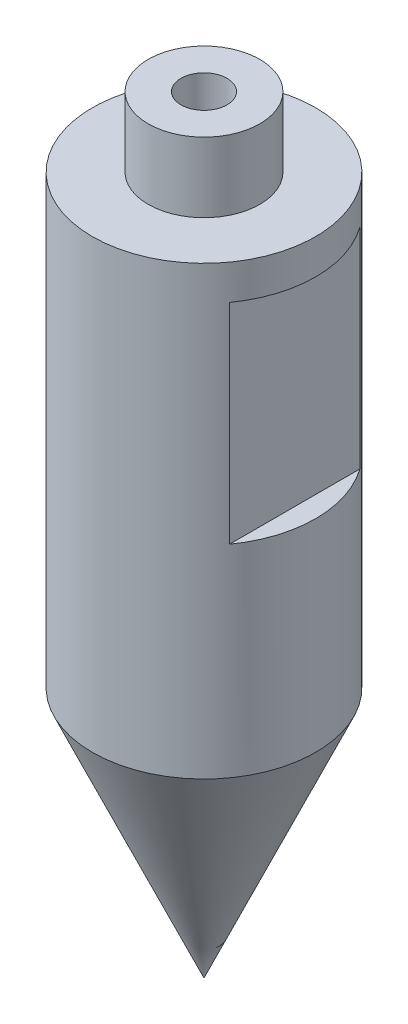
SolidWorks part; units mm, degrees
ref_plane "前视基准面" through (0, 0, 0) normal (0, 0, 1) x (1, 0, 0)
ref_plane "上视基准面" through (0, 0, 0) normal (0, 1, 0) x (1, 0, 0)
ref_plane "右视基准面" through (0, 0, 0) normal (1, 0, 0) x (0, 0, -1)
sketch "草图1" plane through (0, 0, 0) normal (0, 0, 1) x (1, 0, 0)
  line L9 (0, 0) -> (-8, 0)
  line L10 (-8, 0) -> (-8, -32)
  line L14 (0, -50) -> (0, 0)
  line L16 (-8, -32) -> (0, -50)
revolve "旋转1" add sketch "草图1" angle 360 about L14
sketch "草图4" plane through (0, 0, 0) normal (0, 1, 0) x (1, 0, 0)
  line L0 (0, 8) -> (0, -8) construction
  circle A1 centre (0, 0) radius 8 construction
  point P5 (0, 0)
ref_plane "基准面1" through (0, 0, 10.5) normal (0, 0, 1) x (1, 0, 0)
sketch "草图10" plane through (0, 0, 0) normal (0, 1, 0) x (1, 0, 0)
  circle A0 centre (0, 0) radius 4
  dimension "D1" = 8
extrude "凸台-拉伸1" add sketch "草图10" along normal blind 5
sketch "草图19" plane through (0, 0, 0) normal (0, 0, 1) x (1, 0, 0)
  line L0 (0, 5) -> (0, -50) construction
  line L1 (4, 5) -> (-4, 5) construction
  line L3 (-6.5, -17.5) -> (6.5, -17.5) construction
  line L4 (-6.5, -17.5) -> (-6.5, -2.5) construction
  line L5 (-6.5, -2.5) -> (6.5, -2.5) construction
  line L6 (6.5, -17.5) -> (6.5, -2.5) construction
  line L7 (-6.5, -17.5) -> (6.5, -2.5) construction
  line L8 (-6.5, -2.5) -> (6.5, -17.5) construction
  line L9 (6.5, -2.5) -> (46.5, -2.5)
  line L10 (6.5, -2.5) -> (6.5, -17.5)
  line L11 (6.5, -17.5) -> (46.5, -17.5)
  line L12 (46.5, -2.5) -> (46.5, -17.5)
  line L13 (-6.5, -2.5) -> (-46.5, -2.5)
  line L14 (-6.5, -2.5) -> (-6.5, -17.5)
  line L15 (-6.5, -17.5) -> (-46.5, -17.5)
  line L16 (-46.5, -2.5) -> (-46.5, -17.5)
  point P5 (0, -10)
extrude "切除-拉伸1" cut sketch "草图19" against normal through all and the other way through all
hole_wizard "M4 螺纹孔1" positions "草图21" profile "草图22" tap size "M4" standard "ISO"
sketch "草图21" plane through (0, 5, 0) normal (0, 1, 0) x (1, 0, 0)
  point P0 (0, 0)
sketch "草图22" plane through (0, 5, 0) normal (1, 0, 0) x (0, 0, 1)
  line L0 (0, 0) -> (0, 11.0914)
  line L1 (0, 11.0914) -> (1.65, 10.1)
  line L2 (1.65, 10.1) -> (1.65, 0)
  line L5 (1.65, 0) -> (0, 0)
  line L10 (0, 11.0914) -> (-1.65, 10.1) construction
  line L11 (0, -6.35) -> (0, 107.95) construction
  dimension "螺纹孔钻头直径" = 3.3
  dimension "螺纹孔钻头深度" = 10.1
  dimension "导头角度" = 118
equation "\"总长度\"= 50"
equation "\"顶螺纹长度\"=5"
equation "\"台阶长度\"= 10"
equation "\"顶尖长度\"= 15"
equation "\"中段长度\"= \"总长度\" - \"顶螺纹长度\" - \"顶螺纹长度\" - \"台阶长度\""
equation "\"D4@草图1\"=\"总长度\""
equation "\"半径\"= 8"
equation "\"D1@凸台-拉伸1\"=\"顶螺纹长度\""
equation "\"D1@草图19\"=\"中段长度\"/2"
equation "\"D2@草图19\"=\"半径\"*2-3"
equation "\"D1@草图1\"=\"半径\""
